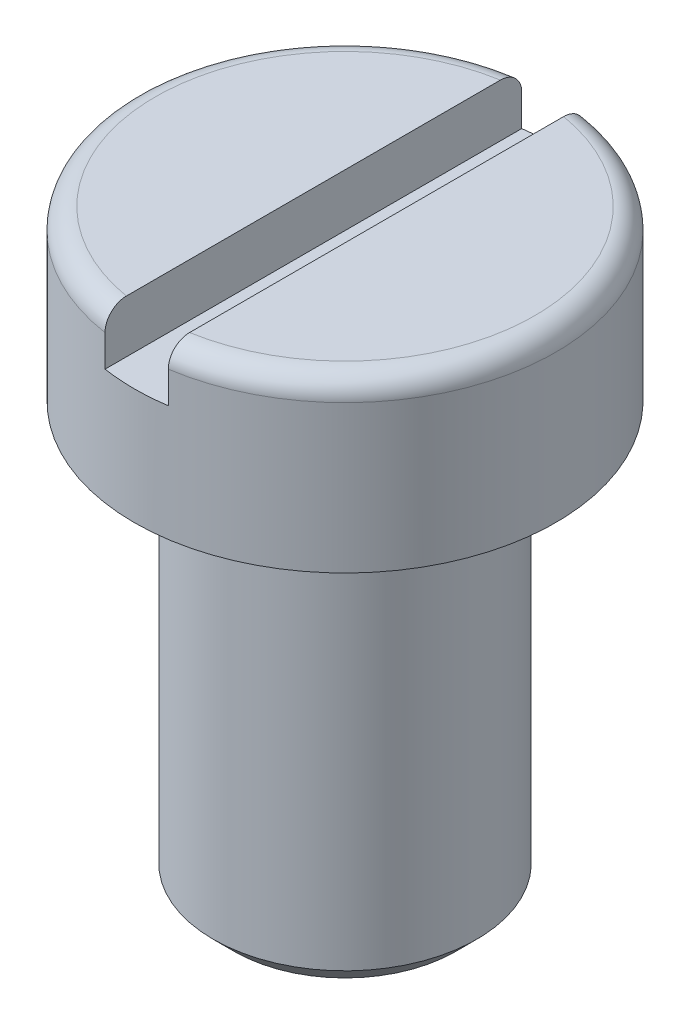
SolidWorks part; units mm, degrees
ref_plane "Front" through (0, 0, 0) normal (0, 0, 1) x (1, 0, 0)
ref_plane "Top" through (0, 0, 0) normal (0, 1, 0) x (1, 0, 0)
ref_plane "Right" through (0, 0, 0) normal (1, 0, 0) x (0, 0, -1)
sketch "Sketch1" plane through (0, 0, 0) normal (0, 0, 1) x (1, 0, 0)
  line L0 (0, 38.5812) -> (0, -39.4168) construction
  line L1 (1.25, 0) -> (1.25, 4)
  line L2 (1.25, 4) -> (2, 4)
  line L3 (2, 4) -> (2, 5.6)
  line L4 (2, 5.6) -> (0, 5.6)
  line L5 (0, 5.6) -> (0, 0)
  line L6 (0, 0) -> (1.25, 0)
  dimension "D1" = 4
  dimension "D2" = 1.25
  dimension "D3" = 1.6
  dimension "D4" = 2
revolve "Screw shape" add sketch "Sketch1" angle 360 about L0
fillet "Fillet1" radius 0.2 1 edges at (0, 5.6, 2)
sketch "Sketch2" plane through (0, 0, 0) normal (0, 0, 1) x (1, 0, 0)
  line L0 (0, 0) -> (0, 5.5978) construction
  line L1 (-0.3, 5.7) -> (-0.3, 5.1)
  line L2 (-0.3, 5.1) -> (0.3, 5.1)
  line L3 (1.8, 5.6) -> (-1.8, 5.6) construction
  line L4 (0.3, 5.7) -> (0.3, 5.1)
  line L5 (-0.3, 5.7) -> (0.3, 5.7)
  point P9 (0, 5.1)
  dimension "D1" = 0.3
  dimension "D2" = 0.5
  dimension "D3" = 0.6
extrude "Slot" cut sketch "Sketch2" against normal mid plane 5
chamfer "Chamfer1" distance 0.2 angle 45 1 edges at (0, 0, 1.25)
